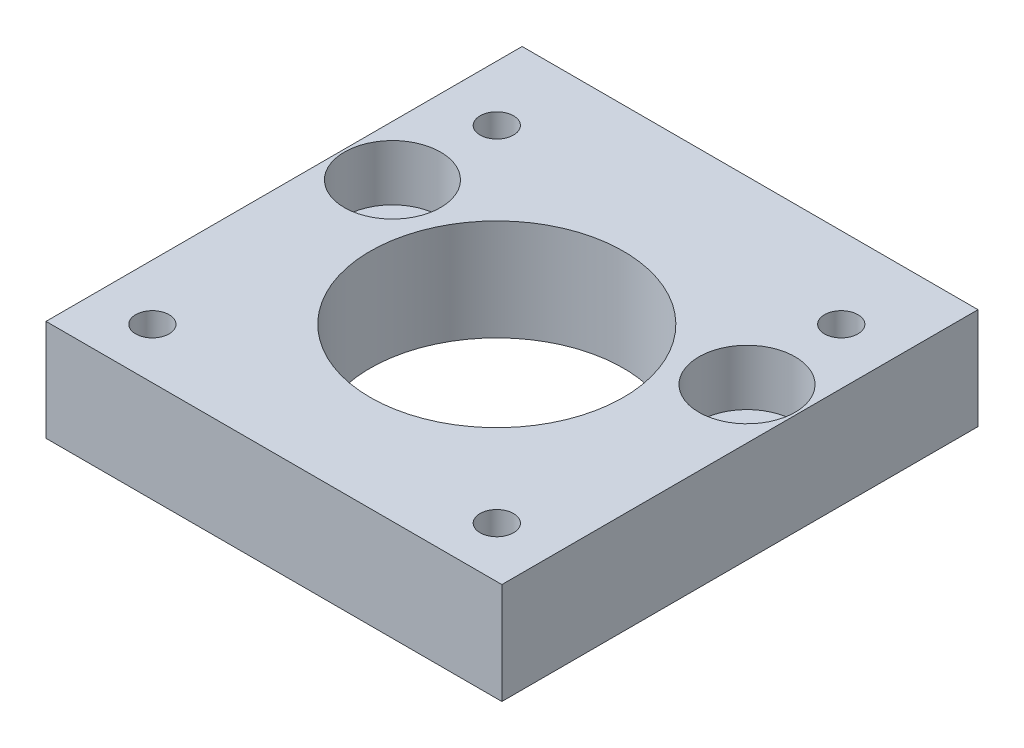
SolidWorks part; units mm, degrees
ref_plane "前视基准面" through (0, 0, 0) normal (0, 0, 1) x (1, 0, 0)
ref_plane "上视基准面" through (0, 0, 0) normal (0, 1, 0) x (1, 0, 0)
ref_plane "右视基准面" through (0, 0, 0) normal (1, 0, 0) x (0, 0, -1)
sketch "草图1" plane through (0, 0, 0) normal (0, 0, 1) x (1, 0, 0)
  line L0 (0, 0) -> (45, 0)
  line L1 (0, 10) -> (45, 10)
  line L2 (0, 0) -> (0, 10)
  line L3 (45, 0) -> (45, 10)
extrude "凸台-拉伸1" add sketch "草图1" along normal blind 47
sketch "草图2" plane through (0, 10, 0) normal (0, 1, 0) x (1, 0, 0)
  circle A0 centre (22.5, -25) radius 12.5
  circle A1 centre (5.5, -8) radius 1.65
  circle A2 centre (39.5, -8) radius 1.65
  circle A3 centre (39.5, -42) radius 1.65
  circle A4 centre (5.5, -42) radius 1.65
  circle A5 centre (40, -17.8) radius 2.75
  circle A6 centre (5, -17.8) radius 2.75
extrude "切除-拉伸2" cut sketch "草图2" against normal blind 47
sketch "草图3" plane through (0, 10, 0) normal (0, 1, 0) x (1, 0, 0)
  circle A0 centre (40, -17.8) radius 4.75
  circle A1 centre (5, -17.8) radius 4.75
extrude "切除-拉伸3" cut sketch "草图3" against normal blind 5.5
